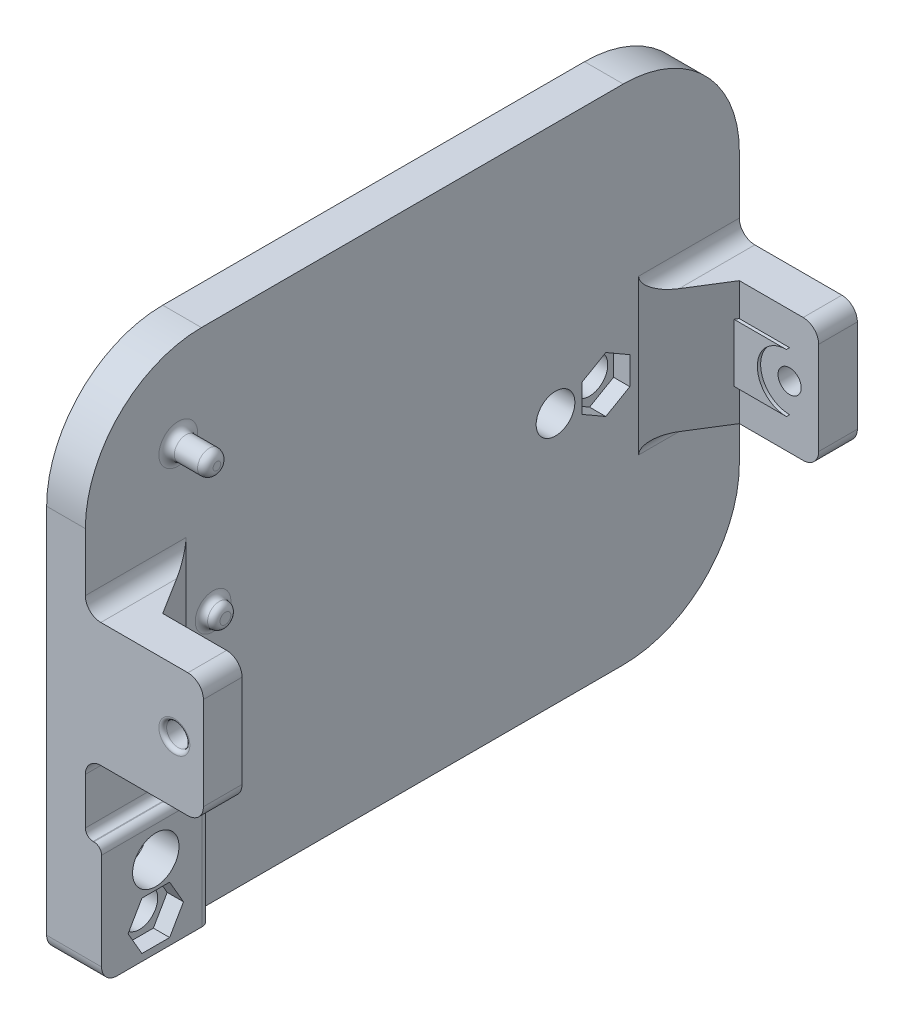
SolidWorks part; units mm, degrees
ref_plane "Front Plane" through (0, 0, 0) normal (1, 0, 0) x (0, 1, 0)
ref_plane "Top Plane" through (0, 0, 0) normal (0, 0, 1) x (0, 1, 0)
ref_plane "Right Plane" through (0, 0, 0) normal (0, 1, 0) x (-1, 0, 0)
sketch "Sketch1" plane through (0, 0, 0) normal (1, 0, 0) x (0, 1, 0)
  line L0 (32.5, 17.25) -> (32.5, 23.75) construction
  line L1 (0, 0) -> (65, 0)
  line L2 (0, 0) -> (0, 84.5)
  line L3 (0, 84.5) -> (65, 84.5)
  line L4 (65, 0) -> (65, 84.5)
  line L5 (10.5, 77.5) -> (4, 77.5) construction
  circle A1 centre (10.5, 77.5) radius 3
  circle A2 centre (32.5, 23.75) radius 2.5
  circle A5 centre (4, 77.5) radius 2.35
  circle A6 centre (32.5, 17.25) radius 2.35
  point P11 (32.5, 84.5)
  dimension "D3" = 7
  dimension "D4" = 6
  dimension "D6" = 60.75
  dimension "D7" = 4.7
  dimension "D9" = 5
  dimension "D1" = 84.5
  dimension "D2" = 65
  dimension "D5" = 22
  dimension "D8" = 28.5
extrude "Boss-Extrude1" add sketch "Sketch1" along normal blind 5
sketch "Sketch3" plane through (5, 0, 0) normal (1, 0, 0) x (0, 1, 0)
  line L0 (65, 84.5) -> (0, 84.5) construction
  line L1 (24.5, 84.5) -> (40.5, 84.5)
  line L2 (24.5, 84.5) -> (24.5, 79.5)
  line L3 (24.5, 79.5) -> (40.5, 79.5)
  line L4 (40.5, 84.5) -> (40.5, 79.5)
  point P6 (32.5, 84.5)
  point P7 (32.5, 79.5)
  dimension "D1" = 5
  dimension "D2" = 16
extrude "Boss-Extrude2" add sketch "Sketch3" along normal blind 15.25
sketch "Sketch4" plane through (0, 0, 79.5) normal (0, 0, -1) x (1, 0, 0)
  line L0 (20.25, -24.5) -> (20.25, -40.5) construction
  circle A0 centre (16.5, -32.5) radius 1.5
  point P4 (20.25, -32.5)
  dimension "D2" = 3
  dimension "D1" = 3.75
extrude "Cut-Extrude1" cut sketch "Sketch4" against normal through all
ref_plane "Plane1" through (0, 0, 42.25) normal (0, 0, -1) x (-1, 0, 0)
mirror "Mirror1" about plane through (0, 0, 42.25) normal (0, 0, -1) of "Cut-Extrude1", "Boss-Extrude2"
sketch "Sketch5" plane through (0, 0, 0) normal (-1, 0, 0) x (0, -1, 0)
  line L0 (-14.177, 81.177) -> (-6.823, 73.823) construction
  line L1 (-6.3988, 74.2473) -> (-7.2473, 73.3988)
  line L2 (-7.2473, 73.3988) -> (-14.6012, 80.7527)
  line L3 (-14.6012, 80.7527) -> (-13.7527, 81.6012)
  line L4 (-13.7527, 81.6012) -> (-6.3988, 74.2473)
  line L6 (0, 84.5) -> (0, 0) construction
  line L7 (-37.7, 23.75) -> (-27.3, 23.75) construction
  line L8 (-27.3, 23.15) -> (-27.3, 24.35)
  line L9 (-27.3, 24.35) -> (-37.7, 24.35)
  line L10 (-37.7, 24.35) -> (-37.7, 23.15)
  line L11 (-37.7, 23.15) -> (-27.3, 23.15)
  line L12 (0, 0) -> (-65, 0) construction
  circle A0 centre (-10.5, 77.5) radius 3 construction
  circle A1 centre (-32.5, 23.75) radius 2.5 construction
  point P4 (-10.5, 77.5)
  point P7 (-6.823, 73.823)
  point P18 (-32.5, 23.75)
  point P22 (-27.3, 23.75)
  dimension "D1" = 10.4
  dimension "D2" = 1.2
  dimension "D3" = 45
extrude "Cut-Extrude2" cut sketch "Sketch5" against normal blind 2
sketch "Sketch6" plane through (5, 0, 0) normal (1, 0, 0) x (0, 1, 0)
  line L0 (0, 84.5) -> (0, 0) construction
  line L1 (0, 84.5) -> (15.5, 84.5)
  line L2 (0, 84.5) -> (0, 70.5)
  line L3 (0, 70.5) -> (15.5, 70.5)
  line L4 (15.5, 84.5) -> (15.5, 70.5)
  line L6 (24.5, 84.5) -> (0, 84.5) construction
  circle A0 centre (10.5, 77.5) radius 3 construction
  circle A2 centre (10.5, 77.5) radius 3
  circle A4 centre (4, 77.5) radius 2.35
  circle A5 centre (4, 77.5) radius 2.35 construction
  point P6 (15.5, 77.5)
  dimension "D2" = 5
extrude "Boss-Extrude3" add sketch "Sketch6" along normal blind 2.1
sketch "Sketch13" plane through (5, 0, 0) normal (1, 0, 0) x (0, 1, 0)
  line L0 (40.5, 84.5) -> (24.5, 84.5) construction
  line L2 (24.5, 79.5) -> (40.5, 79.5) construction
  circle A0 centre (53.5, 72.5) radius 1.5
  point P4 (32.5, 84.5)
  point P7 (45.5, 76.1416)
  dimension "D1" = 3
  dimension "D2" = 21
  dimension "D3" = 7
extrude "Boss-Extrude5" add sketch "Sketch13" along normal blind 5
sketch "Sketch14" plane through (5, 0, 0) normal (1, 0, 0) x (0, 1, 0)
  line L0 (40.5, 84.5) -> (24.5, 84.5) construction
  circle A0 centre (32.5, 68) radius 1.5
  dimension "D2" = 3
  dimension "D1" = 16.5
extrude "Boss-Extrude6" add sketch "Sketch14" along normal blind 1.6
sketch "Sketch7" plane through (2, 0, 0) normal (-1, 0, 0) x (0, -1, 0)
  line L0 (-14.6012, 80.7527) -> (-7.2473, 73.3988)
  line L1 (-7.2473, 73.3988) -> (-6.3988, 74.2473)
  line L2 (-6.3988, 74.2473) -> (-13.7527, 81.6012)
  line L3 (-13.7527, 81.6012) -> (-14.6012, 80.7527)
extrude "Cut-Extrude3" cut sketch "Sketch7" against normal blind 1
sketch "Sketch11" plane through (7.1, 0, 0) normal (1, 0, 0) x (0, 1, 0)
  line L0 (0, 84.5) -> (0, 70.5) construction
  line L1 (7.1, 79.2898) -> (4, 81.0796)
  line L2 (4, 81.0796) -> (0.9, 79.2898)
  line L3 (0.9, 79.2898) -> (0.9, 75.7102)
  line L4 (0.9, 75.7102) -> (4, 73.9204)
  line L5 (4, 73.9204) -> (7.1, 75.7102)
  line L6 (7.1, 75.7102) -> (7.1, 79.2898)
  circle A0 centre (4, 77.5) radius 3.1 construction
  dimension "D1" = 6.2
extrude "Cut-Extrude6" cut sketch "Sketch11" against normal blind 2.1
sketch "Sketch12" plane through (5, 0, 0) normal (1, 0, 0) x (0, 1, 0)
  line L1 (34.2898, 14.15) -> (36.0796, 17.25)
  line L2 (36.0796, 17.25) -> (34.2898, 20.35)
  line L3 (34.2898, 20.35) -> (30.7102, 20.35)
  line L4 (30.7102, 20.35) -> (28.9204, 17.25)
  line L5 (28.9204, 17.25) -> (30.7102, 14.15)
  line L6 (30.7102, 14.15) -> (34.2898, 14.15)
  line L7 (40.5, 0) -> (24.5, 0) construction
  circle A0 centre (32.5, 17.25) radius 3.1 construction
  dimension "D1" = 6.2
extrude "Cut-Extrude7" cut sketch "Sketch12" against normal blind 2.1
fillet "Fillet1" radius 15 3 edges at (2.5, 65, 0) (2.5, 0, 0) (2.5, 65, 84.5)
chamfer "Chamfer1" distance 8 distance2 5 1 edges at (5, 32.5, 79.5)
chamfer "Chamfer2" distance 5 distance2 8 1 edges at (5, 32.5, 5)
fillet "Fillet3" radius 0.5 2 edges at (15, 32.5, 84.5) (15, 32.5, 0)
fillet "Fillet2" radius 2 9 edges at (5, 40.5, 6.5) (5, 24.5, 6.5) (5, 24.5, 78) (5, 40.5, 78) (20.25, 24.5, 2.5) (20.25, 40.5, 2.5) (20.25, 40.5, 82) (20.25, 24.5, 82) (3.55, 0, 84.5)
fillet "Fillet4" radius 1 7 edges at (7.1, 15.5, 77.5) (5, 15.5, 77.5) (7.1, 7.75, 70.5) (5, 7.75, 70.5) (6.05, 15.5, 70.5) (5, 53.5, 74) (10, 53.5, 71)
fillet "Fillet5" radius 0.8 2 edges at (6.6, 32.5, 66.5) (5, 32.5, 69.5)
sketch "Sketch8" plane through (0, 0, 79.5) normal (0, 0, -1) x (1, 0, 0)
  line L2 (9.5, -28.75) -> (16.5, -28.75)
  line L3 (9.5, -36.25) -> (16.5, -36.25)
  line L4 (9.5, -28.75) -> (9.5, -36.25)
  line L5 (10, -24.5) -> (10, -40.5) construction
  arc A0 (16.5, -28.75) -> (16.5, -36.25) centre (16.5, -32.5) ccw
  point P8 (0, 0)
  point P9 (16.5, -32.5)
  dimension "D1" = 3.75
  dimension "D2" = 0.5
extrude "Boss-Extrude4" add sketch "Sketch8" along normal blind 0.42
mirror "Mirror2" about plane through (0, 0, 42.25) normal (0, 0, -1) of "Boss-Extrude4"
